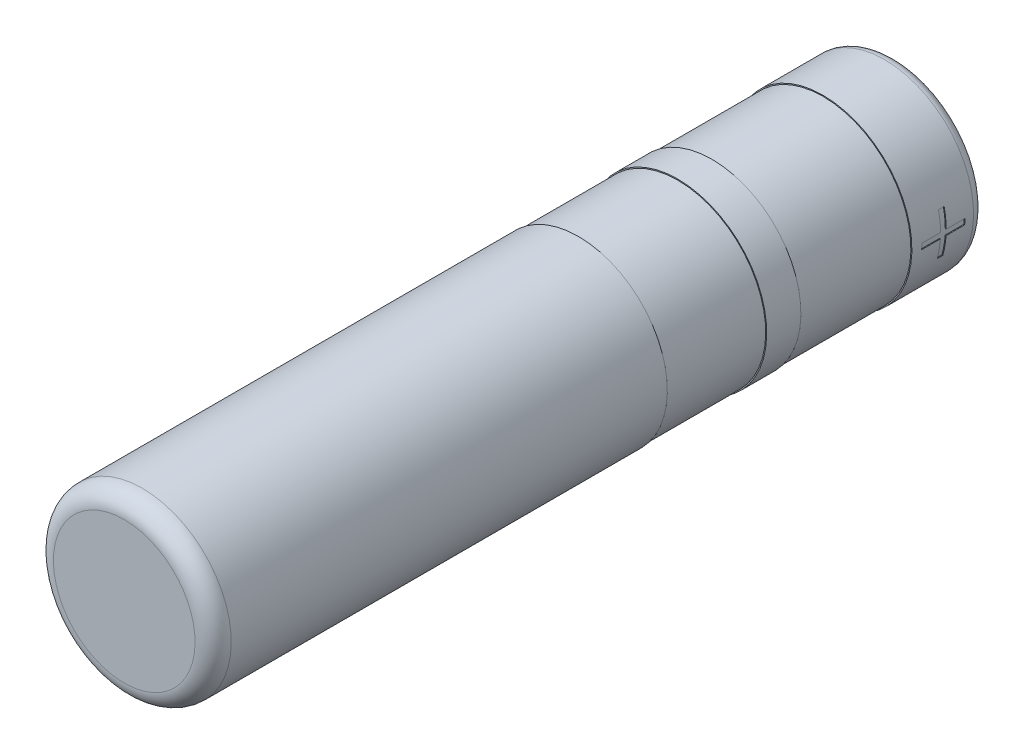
SolidWorks part; units mm, degrees
ref_plane "Plan de face" through (0, 0, 0) normal (0, 0, 1) x (1, 0, 0)
ref_plane "Plan de dessus" through (0, 0, 0) normal (0, 1, 0) x (1, 0, 0)
ref_plane "Plan de droite" through (0, 0, 0) normal (1, 0, 0) x (0, 0, -1)
sketch "Esquisse1" plane through (0, 0, 0) normal (1, 0, 0) x (0, 0, -1)
  line L0 (0, 0) -> (0, 3.915)
  line L1 (1, 4.915) -> (25.1106, 4.915)
  line L2 (42.64, 4.315) -> (42.64, 1.1802)
  line L3 (42.64, 1.1802) -> (43.64, 1.1802)
  line L4 (44.24, 0.5802) -> (44.24, 0)
  line L5 (44.24, 0) -> (0, 0) construction
  line L6 (38.6324, 4.915) -> (42.04, 4.915)
  line L7 (0, 0) -> (44.24, 0)
  line L8 (38.6324, 4.915) -> (38.6324, 4.859)
  line L9 (38.6324, 4.859) -> (32.4958, 4.859)
  line L10 (32.4958, 4.915) -> (32.4958, 4.859)
  line L12 (30.6049, 4.915) -> (30.6049, 4.859)
  line L13 (30.6049, 4.859) -> (25.1106, 4.859)
  line L14 (25.1106, 4.915) -> (25.1106, 4.859)
  line L15 (30.6049, 4.915) -> (32.4958, 4.915)
  arc A0 (0, 3.915) -> (1, 4.915) centre (1, 3.915) cw
  arc A1 (42.04, 4.915) -> (42.64, 4.315) centre (42.04, 4.315) cw
  arc A2 (43.64, 1.1802) -> (44.24, 0.5802) centre (43.64, 0.5802) cw
  dimension "D4" = 1
  dimension "D5" = 0.6
  dimension "D1" = 9.83
  dimension "D2" = 44.24
  dimension "D3" = 42.64
revolve "Révolution1" add sketch "Esquisse1" angle 360 about L5
ref_plane "Plan1" through (5, 0, 0) normal (1, 0, 0) x (0, 0, -1)
sketch "Esquisse2" plane through (5, 0, 0) normal (1, 0, 0) x (0, 0, -1)
  text T0 "+"
extrude "Enlèv. mat.-Extru.1" cut sketch "Esquisse2" against normal offset from surface (0.1445 mm away) 0.05
